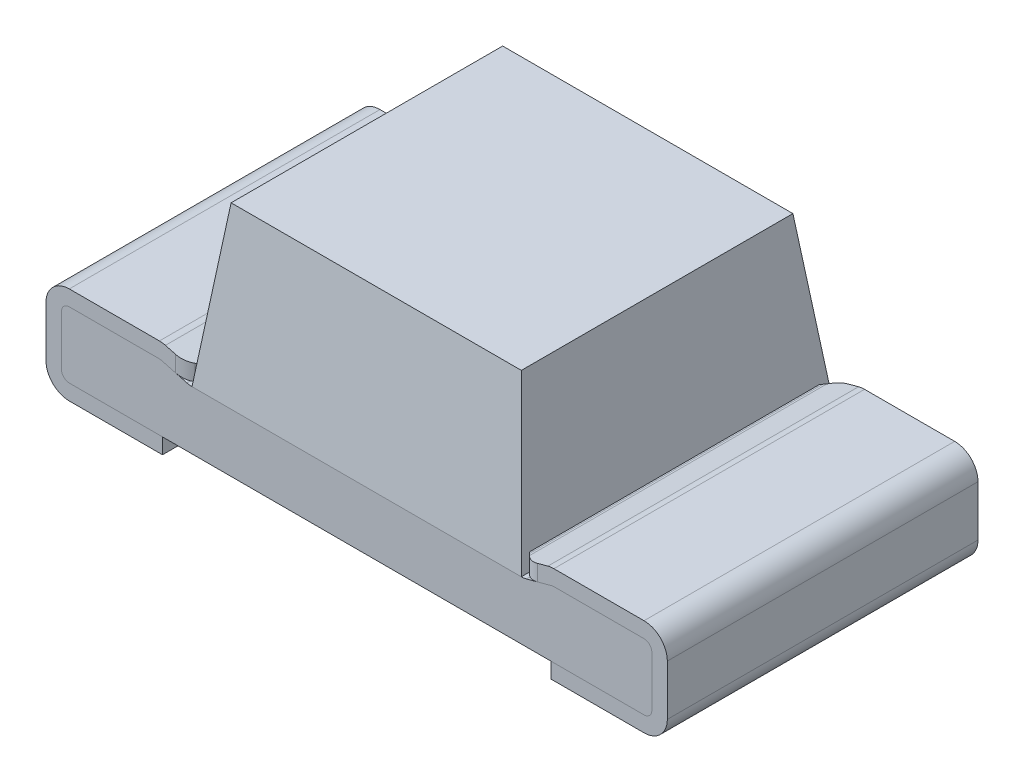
SolidWorks part; units mm, degrees
ref_plane "Front" through (0, 0, 0) normal (0, 0, 1) x (1, 0, 0)
ref_plane "Top" through (0, 0, 0) normal (0, 1, 0) x (1, 0, 0)
ref_plane "Right" through (0, 0, 0) normal (1, 0, 0) x (0, 0, -1)
sketch "Эскиз2" plane through (0, 0, 0) normal (0, 0, 1) x (1, 0, 0)
  line L0 (-0.5, 0) -> (-0.8, 0)
  line L1 (-0.8, 0) -> (-0.8, 0.25)
  line L2 (-0.8, 0.25) -> (-0.5, 0.25)
  line L3 (-0.5, 0.25) -> (-0.4254, 0.23)
  line L4 (-0.4254, 0.23) -> (0.4254, 0.23)
  line L5 (0, 0.23) -> (0, 0) construction
  line L6 (0.5, 0.25) -> (0.4254, 0.23)
  line L7 (0.8, 0.25) -> (0.5, 0.25)
  line L8 (0.8, 0) -> (0.8, 0.25)
  line L9 (0.5, 0) -> (0.8, 0)
  dimension "D1" = 0.25
  dimension "D2" = 0.02
  dimension "D3" = 15
  dimension "D4" = 1.6
  dimension "D5" = 0.3
extrude "Вытянуть-Тонкостенный1" add sketch "Эскиз2" along normal mid plane 0.8 thin
sketch "Sketch1" plane through (0, 0.23, 0) normal (0, 1, 0) x (1, 0, 0)
  line L0 (-0.4454, 0.4) -> (-0.3454, 0.3)
  line L1 (0.4227, 0.4) -> (-0.4227, 0.4) construction
  line L2 (-0.3454, 0.3) -> (0.3454, 0.3)
  line L3 (0, 0.3) -> (0, 0.4) construction
  line L4 (0.4454, 0.4) -> (-0.4454, 0.4)
  line L5 (0.4454, 0.4) -> (0.3454, 0.3)
  line L6 (0, 0) -> (-0.3895, 0) construction
  line L7 (0.4454, -0.4) -> (0.3454, -0.3)
  line L8 (0.4454, -0.4) -> (-0.4454, -0.4)
  line L9 (-0.3454, -0.3) -> (0.3454, -0.3)
  line L10 (-0.4454, -0.4) -> (-0.3454, -0.3)
  dimension "D1" = 45
  dimension "D2" = 0.1
  dimension "D3" = 0.02
extrude "Extrude1" cut sketch "Sketch1" against normal through all and the other way through all
fillet "Fillet1" radius 0.05 4 edges at (-0.4454, 0.2147, -0.4) (0.4454, 0.2147, -0.4) (0.4454, 0.2147, 0.4) (-0.4454, 0.2147, 0.4)
sketch "Эскиз3" plane through (0, 0, 0) normal (0, 0, 1) x (1, 0, 0)
  line L0 (0.5027, 0.2093) -> (0.4661, 0.1995) construction
  line L1 (0.76, 0.06) -> (0.76, 0.19) construction
  line L2 (0.74, 0.21) -> (0.5079, 0.21) construction
  line L3 (-0.3454, 0.19) -> (0.3454, 0.19) construction
  line L4 (-0.4661, 0.1995) -> (-0.5027, 0.2093) construction
  line L5 (0.5027, 0.2093) -> (0.437, 0.1917)
  line L6 (-0.5079, 0.21) -> (-0.74, 0.21) construction
  line L7 (-0.76, 0.19) -> (-0.76, 0.06) construction
  line L8 (-0.74, 0.04) -> (-0.5, 0.04) construction
  line L9 (-0.424, 0.19) -> (0.424, 0.19)
  line L10 (0.76, 0.06) -> (0.76, 0.19)
  line L11 (0.74, 0.21) -> (0.5079, 0.21)
  line L12 (-0.437, 0.1917) -> (-0.5027, 0.2093)
  line L15 (-0.5079, 0.21) -> (-0.74, 0.21)
  line L16 (-0.76, 0.19) -> (-0.76, 0.06)
  line L17 (-0.74, 0.04) -> (0.74, 0.04)
  arc A0 (0.74, 0.04) -> (0.76, 0.06) centre (0.74, 0.06) ccw construction
  arc A1 (0.76, 0.19) -> (0.74, 0.21) centre (0.74, 0.19) ccw construction
  arc A4 (0.5079, 0.21) -> (0.5027, 0.2093) centre (0.5079, 0.19) ccw construction
  arc A6 (-0.74, 0.21) -> (-0.76, 0.19) centre (-0.74, 0.19) ccw construction
  arc A7 (-0.76, 0.06) -> (-0.74, 0.04) centre (-0.74, 0.06) ccw construction
  arc A8 (0.74, 0.04) -> (0.76, 0.06) centre (0.74, 0.06) ccw
  arc A9 (0.76, 0.19) -> (0.74, 0.21) centre (0.74, 0.19) ccw
  arc A10 (0.5079, 0.21) -> (0.5027, 0.2093) centre (0.5079, 0.19) ccw
  arc A11 (-0.5079, 0.21) -> (-0.5027, 0.2093) centre (-0.5079, 0.19) cw
  arc A12 (0.424, 0.19) -> (0.437, 0.1917) centre (0.424, 0.24) ccw
  arc A13 (-0.424, 0.19) -> (-0.437, 0.1917) centre (-0.424, 0.24) cw
  arc A14 (-0.74, 0.21) -> (-0.76, 0.19) centre (-0.74, 0.19) ccw
  arc A15 (-0.76, 0.06) -> (-0.74, 0.04) centre (-0.74, 0.06) ccw
  dimension "D1" = 0.02
  dimension "D2" = 0.05
extrude "Вытянуть1" add sketch "Эскиз3" along normal up to surface and the other way up to surface separate body
sketch "Эскиз4" plane through (0, 0.19, 0) normal (0, 1, 0) x (1, 0, 0)
  line L0 (0.4227, 0.4) -> (-0.4227, 0.4) construction
  line L1 (-0.424, -0.4) -> (0.424, -0.4)
  line L2 (-0.424, -0.4) -> (-0.424, 0.4)
  line L3 (-0.424, 0.4) -> (0.424, 0.4)
  line L4 (0.424, -0.4) -> (0.424, 0.4)
  line L5 (-0.424, -0.4) -> (0.424, 0.4) construction
  line L6 (-0.424, 0.4) -> (0.424, -0.4) construction
  line L7 (0.424, -0.4) -> (-0.424, -0.4) construction
  point P0 (0, 0)
extrude "Вытянуть2" add sketch "Эскиз4" along normal offset from surface 0.6 draft 7 separate body
